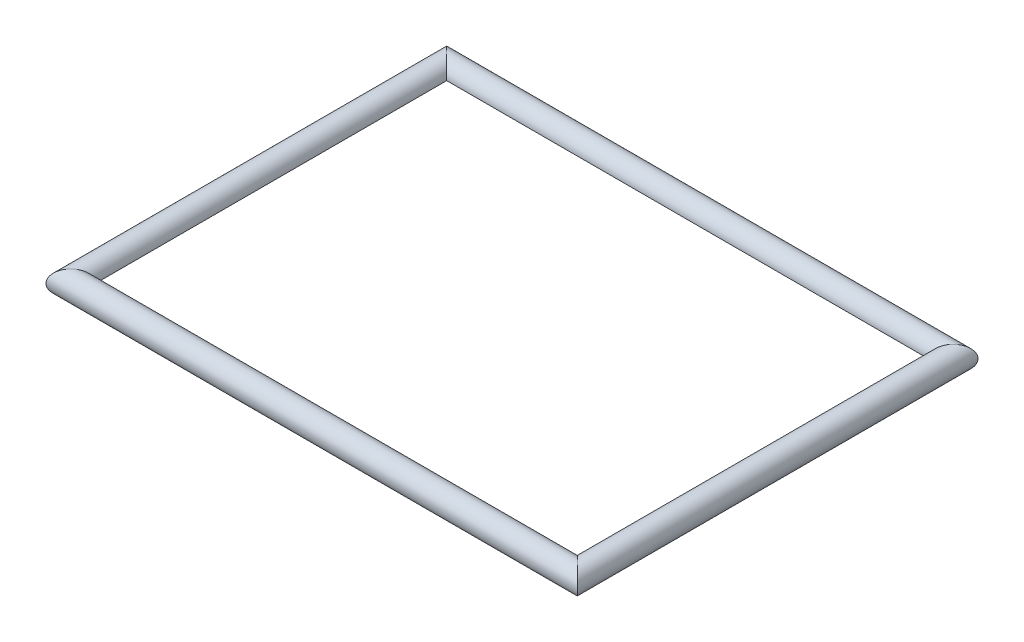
SolidWorks part; units mm, degrees
ref_plane "Front Plane" through (0, 0, 0) normal (0, 0, 1) x (1, 0, 0)
ref_plane "Top Plane" through (0, 0, 0) normal (0, 1, 0) x (1, 0, 0)
ref_plane "Right Plane" through (0, 0, 0) normal (1, 0, 0) x (0, 0, -1)
sketch "Sketch1" plane through (0, 0, 0) normal (0, 1, 0) x (1, 0, 0)
  line L1 (-101.8, 75.55) -> (101.8, 75.55)
  line L2 (-101.8, 75.55) -> (-101.8, -75.55)
  line L3 (-101.8, -75.55) -> (101.8, -75.55)
  line L4 (101.8, 75.55) -> (101.8, -75.55)
  line L5 (-101.8, 75.55) -> (101.8, -75.55) construction
  line L6 (-101.8, -75.55) -> (101.8, 75.55) construction
  point P0 (0, 0)
  dimension "D1" = 203.6
  dimension "D2" = 151.1
sweep "Sweep1" add path "Sketch1" parameters "D3"=10
sketch "Sketch7" plane through (0, 0, 0) normal (0, 1, 0) x (1, 0, 0)
  line L0 (106.8, -80.55) -> (96.8, -70.55) construction
  line L1 (-101.8, 75.55) -> (101.8, 75.55)
  line L2 (-101.8, 75.55) -> (-101.8, -75.55)
  line L3 (-101.8, -75.55) -> (101.8, -75.55)
  line L4 (101.8, 75.55) -> (101.8, -75.55)
  line L5 (-101.8, 75.55) -> (101.8, -75.55) construction
  line L6 (-101.8, -75.55) -> (101.8, 75.55) construction
  point P0 (0, 0)
  point P8 (-101.8, 75.55)
  point P9 (101.8, 75.55)
extrude "Cut-Extrude1" cut sketch "Sketch7" against normal up to next
